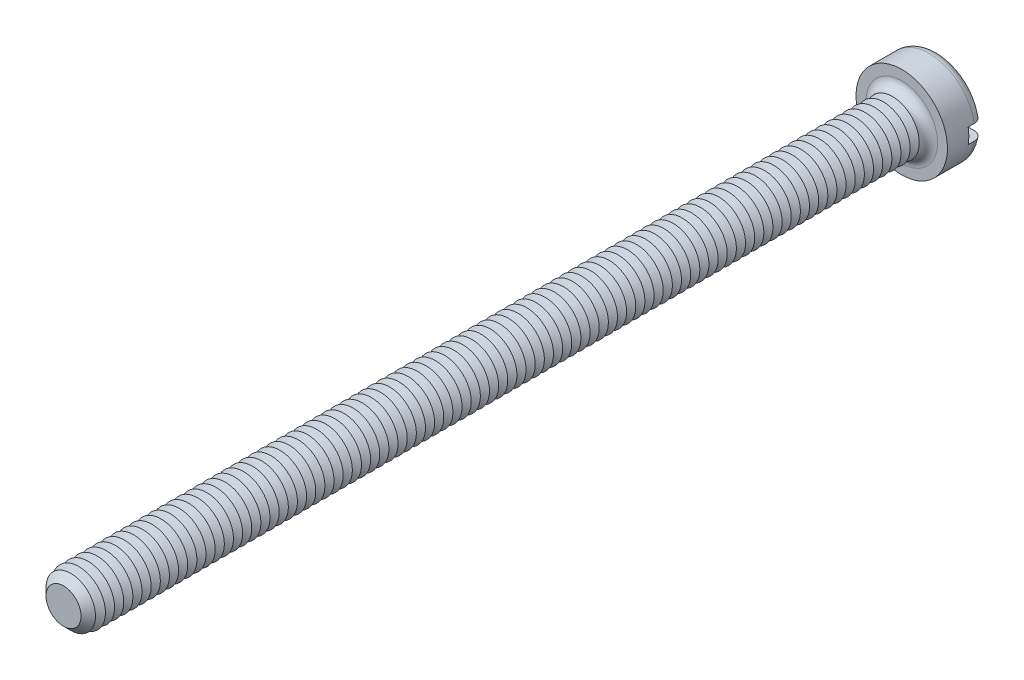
SolidWorks part; units mm, degrees
ref_plane "Front Plane" through (0, 0, 0) normal (0, 0, 1) x (1, 0, 0)
ref_plane "Top Plane" through (0, 0, 0) normal (0, 1, 0) x (1, 0, 0)
ref_plane "Right Plane" through (0, 0, 0) normal (1, 0, 0) x (0, 0, -1)
sketch "Sketch3" plane through (0, 0, 0) normal (0, 0, 1) x (1, 0, 0)
  circle A0 centre (0, 0) radius 3
  dimension "D1" = 6
extrude "Boss-Extrude2" add sketch "Sketch3" against normal blind 2.4
sketch "Sketch4" plane through (0, 0, 0) normal (0, 0, 1) x (1, 0, 0)
  circle A0 centre (0, 0) radius 1.75
  dimension "D1" = 3.5
extrude "Boss-Extrude3" add sketch "Sketch4" along normal blind 55
fillet "Fillet1" radius 0.6 2 edges at (3, 0, -2.4) (1.75, 0, 0)
chamfer "Chamfer1" distance 0.6 angle 45 1 edges at (1.75, 0, 55)
sketch "Sketch5" plane through (0, 0, 0) normal (1, 0, 0) x (0, 0, -1)
  line L0 (1.6944, 0) -> (-7.6738, 0) construction
sketch "Sketch6" plane through (0, 0, 0) normal (1, 0, 0) x (0, 0, -1)
  line L0 (-0.6, 1.75) -> (-0.9, 1.2304)
  line L1 (-0.9, 1.2304) -> (-1.2, 1.75)
  line L2 (-0.6, 1.75) -> (-54.4, 1.75) construction
  line L3 (-1.2, 1.75) -> (-0.6, 1.75)
  dimension "D1" = 0.6
revolve "Cut-Revolve1" cut sketch "Sketch6" angle 360 about L0
pattern_linear "LPattern1" count 90 spacing 0.6 along (0, 0, 1) of "Cut-Revolve1"
sketch "Sketch8" plane through (0, 0, -2.4) normal (0, 0, -1) x (-1, 0, 0)
  line L1 (3, -0.5) -> (-3, -0.5)
  line L2 (3, -0.5) -> (3, 0.5)
  line L3 (3, 0.5) -> (-3, 0.5)
  line L4 (-3, -0.5) -> (-3, 0.5)
  line L5 (3, -0.5) -> (-3, 0.5) construction
  line L6 (3, 0.5) -> (-3, -0.5) construction
  point P0 (0, 0)
  dimension "D1" = 6
  dimension "D2" = 1
extrude "Cut-Extrude1" cut sketch "Sketch8" against normal blind 1
